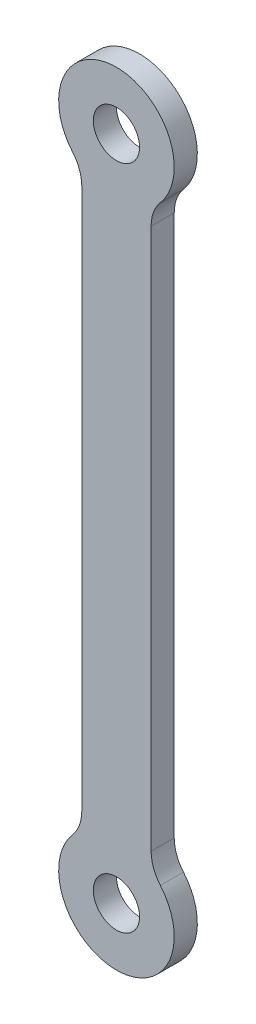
SolidWorks part; units mm, degrees
ref_plane "Plan de face" through (0, 0, 0) normal (0, 0, 1) x (1, 0, 0)
ref_plane "Plan de dessus" through (0, 0, 0) normal (0, 1, 0) x (1, 0, 0)
ref_plane "Plan de droite" through (0, 0, 0) normal (1, 0, 0) x (0, 0, -1)
sketch "Esquisse1" plane through (0, 0, 0) normal (0, 0, 1) x (1, 0, 0)
  line L0 (0, 0) -> (0, 193.0476) construction
  line L1 (-9, 12) -> (-9, 161)
  line L2 (9, 12) -> (9, 161)
  arc A0 (-9, 12) -> (9, 12) centre (0, 0) ccw
  arc A1 (9, 161) -> (-9, 161) centre (0, 173) ccw
  circle A2 centre (0, 173) radius 6
  circle A3 centre (0, 0) radius 6
  dimension "D1" = 30
  dimension "D2" = 30
  dimension "D3" = 173
  dimension "D6" = 12
  dimension "D7" = 12
  dimension "D4" = 18
  dimension "D5" = 9
extrude "Extrusion1" add sketch "Esquisse1" along normal blind 6
fillet "Congé1" radius 10 4 edges at (9, 161, 3) (9, 12, 3) (-9, 12, 3) (-9, 161, 3)
